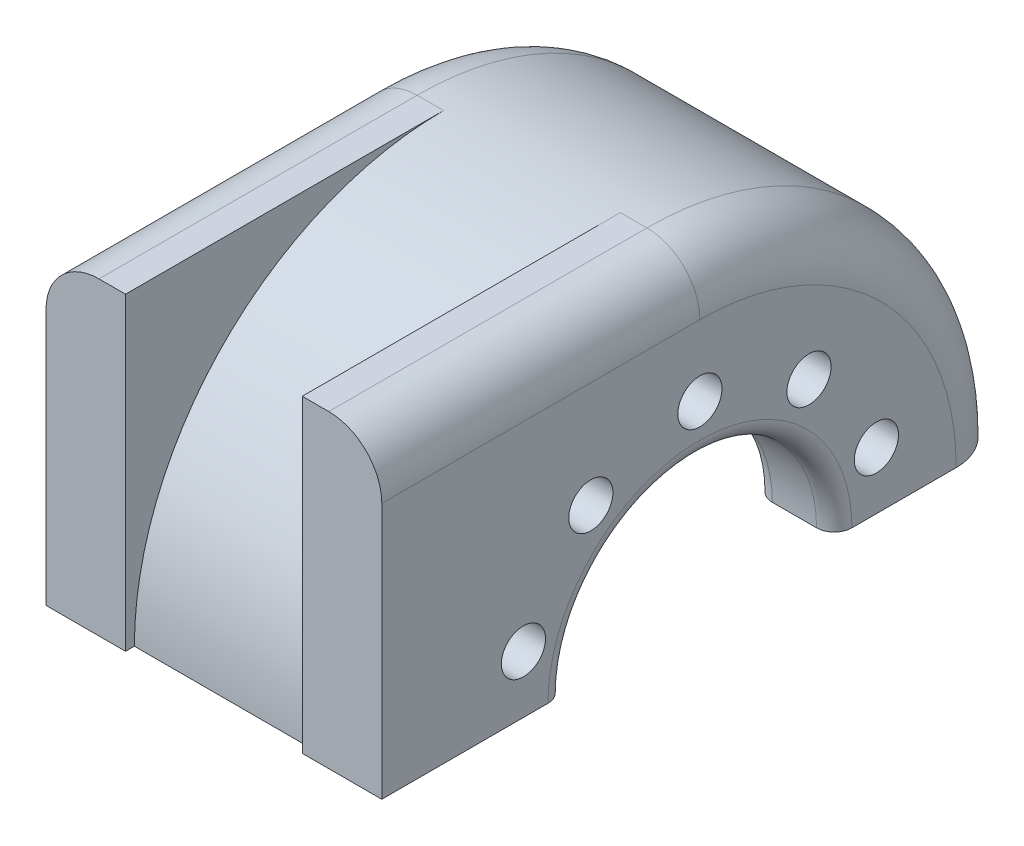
SolidWorks part; units mm, degrees
ref_plane "Front Plane" through (0, 0, 0) normal (0, 0, 1) x (1, 0, 0)
ref_plane "Top Plane" through (0, 0, 0) normal (0, 1, 0) x (1, 0, 0)
ref_plane "Right Plane" through (0, 0, 0) normal (1, 0, 0) x (0, 0, -1)
sketch "Schizzo1" plane through (0, 0, 0) normal (1, 0, 0) x (0, 0, -1)
  line L0 (0, -175) -> (0, 175) construction
  line L1 (-180, 175) -> (-180, -175)
  line L2 (-180, -175) -> (0, -175)
  line L3 (-180, 175) -> (0, 175)
  line L4 (-180, 0) -> (175, 0) construction
  arc A1 (0, -175) -> (0, 175) centre (0, 0) ccw
  dimension "D1" = 350
  dimension "D2" = 175
  dimension "D3" = 355
extrude "Estrusione-Estrusione2" add sketch "Schizzo1" against normal blind 190
sketch "Schizzo3" plane through (0, 0, 0) normal (1, 0, 0) x (0, 0, -1)
  circle A0 centre (0, 0) radius 76
  dimension "D1" = 152
extrude "Taglio-Estrusione1" cut sketch "Schizzo3" against normal through all
sketch "Schizzo4" plane through (-190, 0, 0) normal (-1, 0, 0) x (0, 0, 1)
  circle A0 centre (0, 0) radius 101
  dimension "D1" = 202
extrude "Taglio-Estrusione2" cut sketch "Schizzo4" against normal blind 45
sketch "Schizzo5" plane through (-145, 0, 0) normal (-1, 0, 0) x (0, 0, 1)
  circle A0 centre (0, 0) radius 131
  dimension "D1" = 262
extrude "Taglio-Estrusione3" cut sketch "Schizzo5" against normal blind 100
sketch "Schizzo6" plane through (0, 0, 0) normal (1, 0, 0) x (0, 0, -1)
  line L0 (0, 0) -> (105, 0) construction
  line L2 (-99.8609, 32.4468) -> (99.8609, -32.4468) construction
  circle A0 centre (0, 0) radius 105 construction
  point P37 (0, 0)
  dimension "D1" = 210
  dimension "D2" = 18
hole_wizard "Ø25.0mm Dowel Hole1" positions "Schizzo3D1" profile "Schizzo8" hole size "Ø25.0" standard "ISO"
sketch3d "Schizzo3D1"
  point P21 (0, 32.4468, 99.8609)
sketch "Schizzo8" plane through (0, 32.4468, 99.8609) normal (0, 1, 0) x (0, 0, -1)
  line L0 (0, 0) -> (0, 52.5108)
  line L1 (0, 52.5108) -> (12.5, 45)
  line L2 (12.5, 45) -> (12.5, 0)
  line L5 (12.5, 0) -> (0, 0)
  line L10 (0, 52.5108) -> (-12.5, 45) construction
  line L11 (0, -6.35) -> (0, 107.95) construction
  dimension "Hole Dia." = 25
  dimension "Hole Depth" = 45
  dimension "Drill Angle" = 118
sketch "Schizzo10" plane through (0, 0, 0) normal (1, 0, 0) x (0, 0, -1)
  line L0 (-180, 0) -> (175, 0)
  line L1 (-180, 175) -> (-180, -175) construction
  line L3 (175, 0) -> (175, -175)
  line L4 (175, -175) -> (-180, -175)
  line L5 (-180, -175) -> (-180, 0)
  arc A0 (0, -175) -> (0, 175) centre (0, 0) ccw construction
extrude "Taglio-Estrusione4" cut sketch "Schizzo10" against normal through all
fillet "Raccordo1" radius 5 1 edges at (-145, 101, 0)
sketch "Schizzo11" plane through (0, 0, 0) normal (0, 1, 0) x (1, 0, 0)
  line L0 (0, 0) -> (-137.8055, 0) construction
fillet "Raccordo2" radius 5 2 edges at (-45, 131, 0) (-145, 131, 0)
fillet "Raccordo3" radius 10 1 edges at (-45, 76, 0)
pattern_circular "RipetizioneCircolare1" count 10 over 360 about axis through (0, 0, 0) along (-1, 0, 0) of "Ø25.0mm Dowel Hole1"
sketch "Schizzo12" plane through (0, 0, 0) normal (1, 0, 0) x (0, 0, -1)
  line L0 (0, 0) -> (99.8609, 32.4468) construction
fillet "Raccordo4" radius 10 1 edges at (0, 76, 0)
fillet "Raccordo5" radius 30 4 edges at (-190, 175, 90) (-190, 123.7437, -123.7437) (0, 123.7437, -123.7437) (0, 175, 90)
ref_plane "Piano1" through (-145, 0, 0) normal (1, 0, 0) x (0, 0, -1)
sketch "Schizzo13" plane through (-145, 0, 0) normal (1, 0, 0) x (0, 0, -1)
  line L0 (0, 175) -> (-180, 175)
  line L1 (-180, 175) -> (-180, 0)
  line L2 (-180, 0) -> (-175, 0)
  arc A0 (0, 175) -> (-175, 0) centre (0, 0) ccw
extrude "Taglio-Estrusione5" cut sketch "Schizzo13" along normal blind 100
sketch "Schizzo14" plane through (0, 0, 180) normal (0, 0, 1) x (1, 0, 0)
  line L0 (0, -105) -> (0, 105) construction
  line L1 (-190, 145) -> (-190, 0) construction
  line L2 (-190, 0) -> (-145, 0) construction
  line L3 (0, 0) -> (-137.8055, 0) construction
  point P0 (-20, 40)
  point P1 (-170, 40)
  dimension "D1" = 20
  dimension "D2" = 20
  dimension "D3" = 40
  dimension "D4" = 40
hole_wizard "Foro filettato M10-1" positions "Schizzo3D2" profile "Schizzo15" tap size "M10" standard "ISO"
sketch3d "Schizzo3D2"
  point P0 (-20, 40, 180)
  point P3 (-170, 40, 180)
sketch "Schizzo15" plane through (-20, 40, 180) normal (1, 0, 0) x (0, -1, 0)
  line L0 (0, 0) -> (0, 27.5537)
  line L1 (0, 27.5537) -> (4.25, 25)
  line L2 (4.25, 25) -> (4.25, 0)
  line L5 (4.25, 0) -> (0, 0)
  line L10 (0, 27.5537) -> (-4.25, 25) construction
  line L11 (0, -6.35) -> (0, 107.95) construction
  dimension "Tap Drill Dia." = 8.5
  dimension "Tap Drill Depth" = 25
  dimension "Drill Angle" = 118
sketch "Schizzo16" plane through (0, 0, 180) normal (0, 0, 1) x (1, 0, 0)
  line L0 (0, -105) -> (0, 105) construction
  line L1 (-190, 145) -> (-190, 0) construction
  line L2 (-190, 0) -> (-145, 0) construction
  line L3 (0, 0) -> (-137.8055, 0) construction
  point P0 (-20, 80)
  point P1 (-170, 80)
  dimension "D1" = 20
  dimension "D2" = 20
  dimension "D3" = 80
  dimension "D4" = 80
hole_wizard "Foro filettato M10-2" positions "Schizzo3D3" profile "Schizzo17" tap size "M10" standard "ISO"
sketch3d "Schizzo3D3"
  point P0 (-20, 80, 180)
  point P3 (-170, 80, 180)
sketch "Schizzo17" plane through (-20, 80, 180) normal (1, 0, 0) x (0, -1, 0)
  line L0 (0, 0) -> (0, 37.5537)
  line L1 (0, 37.5537) -> (4.25, 35)
  line L2 (4.25, 35) -> (4.25, 0)
  line L5 (4.25, 0) -> (0, 0)
  line L10 (0, 37.5537) -> (-4.25, 35) construction
  line L11 (0, -6.35) -> (0, 107.95) construction
  dimension "Tap Drill Dia." = 8.5
  dimension "Tap Drill Depth" = 35
  dimension "Drill Angle" = 118
sketch "Schizzo18" plane through (0, 0, 180) normal (0, 0, 1) x (1, 0, 0)
  line L0 (0, 145) -> (0, 0) construction
  line L1 (-190, 145) -> (-190, 0) construction
  line L2 (0, 0) -> (-137.8055, 0) construction
  line L3 (-190, 0) -> (-145, 0) construction
  point P0 (-20, 120)
  point P1 (-170, 120)
  point P10 (-167.5, 0)
  dimension "D1" = 20
  dimension "D2" = 20
  dimension "D3" = 120
  dimension "D4" = 120
hole_wizard "Foro filettato M10-3" positions "Schizzo3D4" profile "Schizzo19" tap size "M10" standard "ISO"
sketch3d "Schizzo3D4"
  point P0 (-20, 120, 180)
  point P3 (-170, 120, 180)
sketch "Schizzo19" plane through (-20, 120, 180) normal (1, 0, 0) x (0, -1, 0)
  line L0 (0, 0) -> (0, 47.5537)
  line L1 (0, 47.5537) -> (4.25, 45)
  line L2 (4.25, 45) -> (4.25, 0)
  line L5 (4.25, 0) -> (0, 0)
  line L10 (0, 47.5537) -> (-4.25, 45) construction
  line L11 (0, -6.35) -> (0, 107.95) construction
  dimension "Tap Drill Dia." = 8.5
  dimension "Tap Drill Depth" = 45
  dimension "Drill Angle" = 118
sketch "Schizzo20" plane through (0, 0, 0) normal (1, 0, 0) x (0, 0, -1)
  line L0 (0, 0) -> (-280, 0) construction
  dimension "D1" = 280
